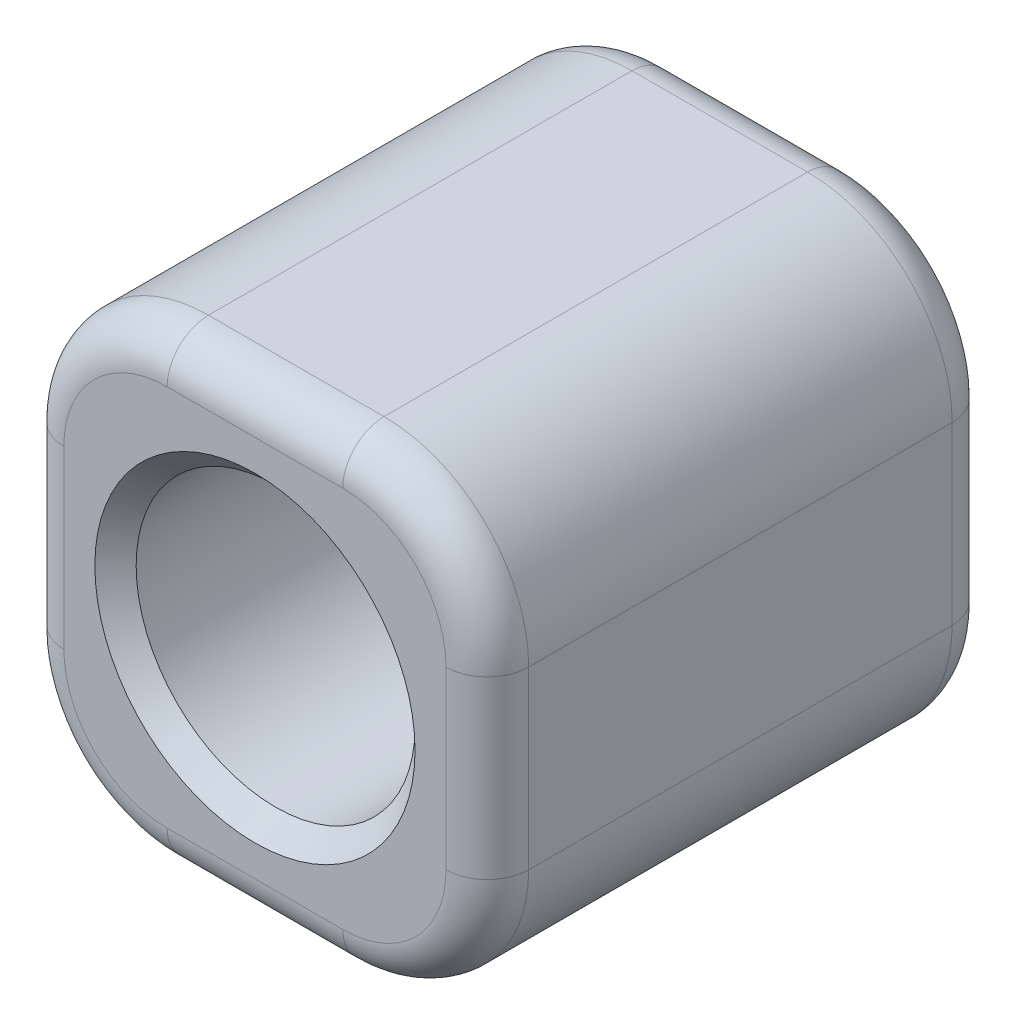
SolidWorks part; units mm, degrees
ref_plane "Plan1" through (0, 0, 0) normal (0, 0, 1) x (1, 0, 0)
ref_plane "Plan2" through (0, 0, 0) normal (0, 1, 0) x (1, 0, 0)
ref_plane "Plan3" through (0, 0, 0) normal (1, 0, 0) x (0, 0, -1)
sketch "Esquisse1" plane through (0, 0, 0) normal (0, 0, 1) x (1, 0, 0)
  line L0 (-11.25, -4.25) -> (-11.25, 4.25)
  line L1 (-4.25, 11.25) -> (4.25, 11.25)
  line L2 (18, 0) -> (-21, 0) construction
  line L3 (0, -11) -> (0, 20) construction
  line L4 (-4.25, -11.25) -> (4.25, -11.25)
  line L5 (11.25, -4.25) -> (11.25, 4.25)
  circle A0 centre (0, 0) radius 6.75
  arc A1 (-4.25, 11.25) -> (-11.25, 4.25) centre (-4.25, 4.25) ccw
  arc A2 (-4.25, -11.25) -> (-11.25, -4.25) centre (-4.25, -4.25) cw
  arc A3 (4.25, 11.25) -> (11.25, 4.25) centre (4.25, 4.25) cw
  arc A4 (4.25, -11.25) -> (11.25, -4.25) centre (4.25, -4.25) ccw
  point P8 (-11.25, 11.25)
  point P14 (0, 11.25)
  point P18 (-11.25, 0)
  point P23 (0, -11.25)
  dimension "D1" = 13.5
  dimension "D4" = 7
  dimension "D2" = 11.25
  dimension "D3" = 11.25
extrude "Base-Extrusion" add sketch "Esquisse1" along normal blind 24.5
fillet "Congé1" radius 2
chamfer "Chanfrein1" distance 1 angle 45
